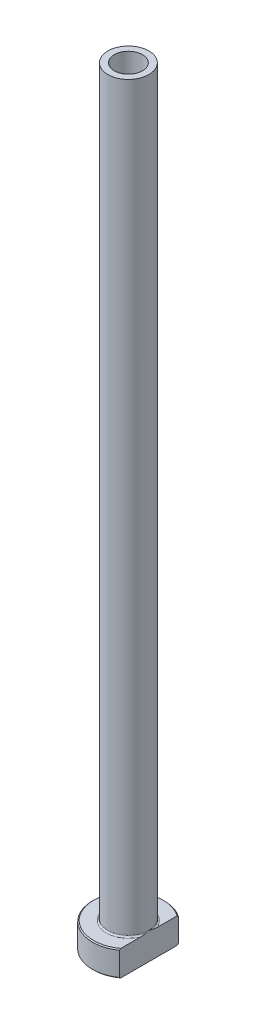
SolidWorks part; units mm, degrees
ref_plane "Front Plane" through (0, 0, 0) normal (0, 0, 1) x (1, 0, 0)
ref_plane "Top Plane" through (0, 0, 0) normal (0, 1, 0) x (1, 0, 0)
ref_plane "Right Plane" through (0, 0, 0) normal (1, 0, 0) x (0, 0, -1)
sketch "Sketch1" plane through (0, 0, 0) normal (0, 0, 1) x (1, 0, 0)
  line L0 (-2.75, 150) -> (-4, 150)
  line L1 (-4, 150) -> (-4, 5)
  line L2 (-4, 5) -> (-7, 5)
  line L3 (-7, 5) -> (-7, 0)
  line L4 (6.05, 0) -> (-6.05, 0) construction
  line L5 (-7, 0) -> (-3, 0)
  line L6 (-2.75, 105) -> (-2.75, 150)
  line L7 (0, 92.1877) -> (0, -15.5353) construction
  line L8 (0, -7.7) -> (0, 7.7) construction
  line L9 (-2.75, 105) -> (-3, 93)
  line L10 (-3, 93) -> (-3, 0)
  dimension "D1" = 0.25
  dimension "ID" = 5.5
  dimension "OD" = 8
  dimension "L" = 150
  dimension "H" = 14
  dimension "T" = 5
  dimension "N" = 45
  dimension "D2" = 12
  dimension "L-N" = 105
revolve "Revolve1" add sketch "Sketch1" angle 360 about L7
fillet "Fillet1" radius 0.3 1 edges at (0, 5, 4)
chamfer "Chamfer1" distance 0.2 angle 45 2 edges at (0, 5, 7) (0, 0, 7)
sketch "Sketch2" plane through (0, 0, 0) normal (0, -1, 0) x (1, 0, 0)
  line L0 (4, 5.7446) -> (4, -5.7446)
  circle A0 centre (0, 0) radius 7 construction
  arc A1 (4, 5.7446) -> (4, -5.7446) centre (0, 0) cw
  circle A2 centre (0, 0) radius 4 construction
extrude "Cut-Extrude1" cut sketch "Sketch2" against normal through all
chamfer "Chamfer2" distance 0.5 angle 45 1 edges at (0, 0, 3)
